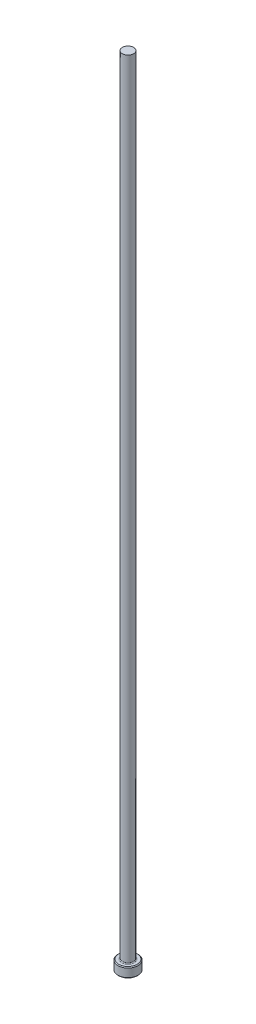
SolidWorks part; units mm, degrees
ref_plane "Front Plane" through (0, 0, 0) normal (0, 0, 1) x (1, 0, 0)
ref_plane "Top Plane" through (0, 0, 0) normal (0, 1, 0) x (1, 0, 0)
ref_plane "Right Plane" through (0, 0, 0) normal (1, 0, 0) x (0, 0, -1)
sketch "Sketch1" plane through (0, 0, 0) normal (0, 0, 1) x (1, 0, 0)
  line L0 (0, 259.9588) -> (0, -15.1925) construction
  line L1 (0, 0) -> (-3.175, 0)
  line L2 (-3.175, 0) -> (-3.175, 3.175)
  line L3 (-3.175, 3.175) -> (-1.7856, 3.175)
  line L4 (-1.7856, 3.175) -> (-1.7856, 254)
  line L5 (-1.7856, 254) -> (0, 254)
  line L6 (0, 254) -> (0, 0)
  dimension "L" = 254
  dimension "H" = 6.35
  dimension "T" = 3.175
  dimension "D" = 3.5712
revolve "Revolve1" add sketch "Sketch1" angle 360 about L0
chamfer "Chamfer1" distance 0.254 angle 45 2 edges at (0, 3.175, 3.175) (0, 0, 3.175)
fillet "Fillet1" radius 0.254 1 edges at (0, 3.175, 1.7856)
sketch "Pocket Sketch" plane through (0, 0, 0) normal (0, 0, 1) x (1, 0, 0)
  line L0 (-3.5719, 0) -> (-3.5719, 3.2004)
  line L1 (-3.5719, 3.2004) -> (-2.7461, 3.2004)
  line L2 (-1.9841, 3.9624) -> (-1.9841, 22.225)
  line L3 (-1.9841, 22.225) -> (0, 22.225)
  line L4 (0, 22.225) -> (0, 0)
  line L5 (0, 0) -> (-3.5719, 0)
  line L6 (0, 12.6104) -> (0, -2.4989) construction
  line L7 (-3.175, 2.921) -> (-3.175, 0.254) construction
  line L8 (2.921, 3.175) -> (-2.921, 3.175) construction
  line L9 (-1.7856, 254) -> (-1.7856, 3.429) construction
  line L10 (-2.7461, 3.2004) -> (-1.9841, 3.9624)
  point P3 (-1.9841, 3.2004)
  dimension "D1" = 7.1437
  dimension "D2" = 0.3969
  dimension "D3" = 0.0254
  dimension "D4" = 0.1984
  dimension "D5" = 3.9681
  dimension "D6" = 22.225
